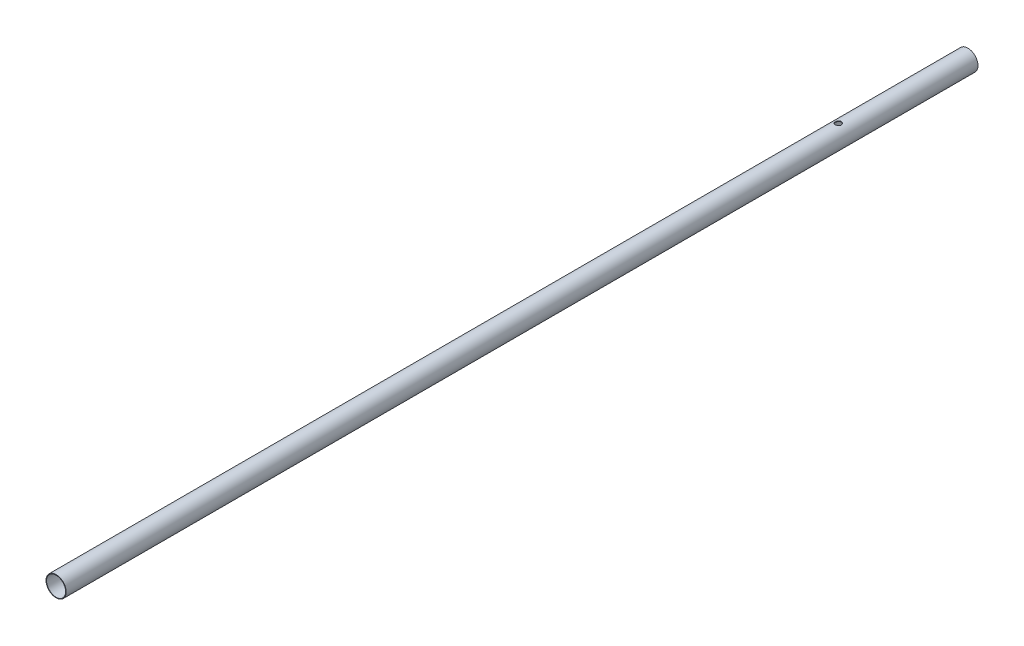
SolidWorks part; units mm, degrees
ref_plane "Plan de face" through (0, 0, 0) normal (0, 0, 1) x (1, 0, 0)
ref_plane "Plan de dessus" through (0, 0, 0) normal (0, 1, 0) x (1, 0, 0)
ref_plane "Plan de droite" through (0, 0, 0) normal (1, 0, 0) x (0, 0, -1)
sketch "Esquisse1" plane through (0, 0, 0) normal (0, 0, 1) x (1, 0, 0)
  circle A0 centre (0, 0) radius 17
  dimension "D1" = 34
extrude "Extrusion1" add sketch "Esquisse1" along normal blind 1532
sketch "Esquisse2" plane through (0, 0, 1532) normal (0, 0, 1) x (1, 0, 0)
  circle A0 centre (0, 0) radius 16
  dimension "D1" = 32
extrude "Enlèv. mat.-Extru.1" cut sketch "Esquisse2" against normal through all
ref_plane "Plan1" through (0, 10, 0) normal (0, 1, 0) x (-1, 0, 0)
sketch "Esquisse3" plane through (0, 10, 0) normal (0, 1, 0) x (-1, 0, 0)
  circle A0 centre (0, 218) radius 5
extrude "Enlèv. mat.-Extru.2" cut sketch "Esquisse3" against normal through all and the other way through all
